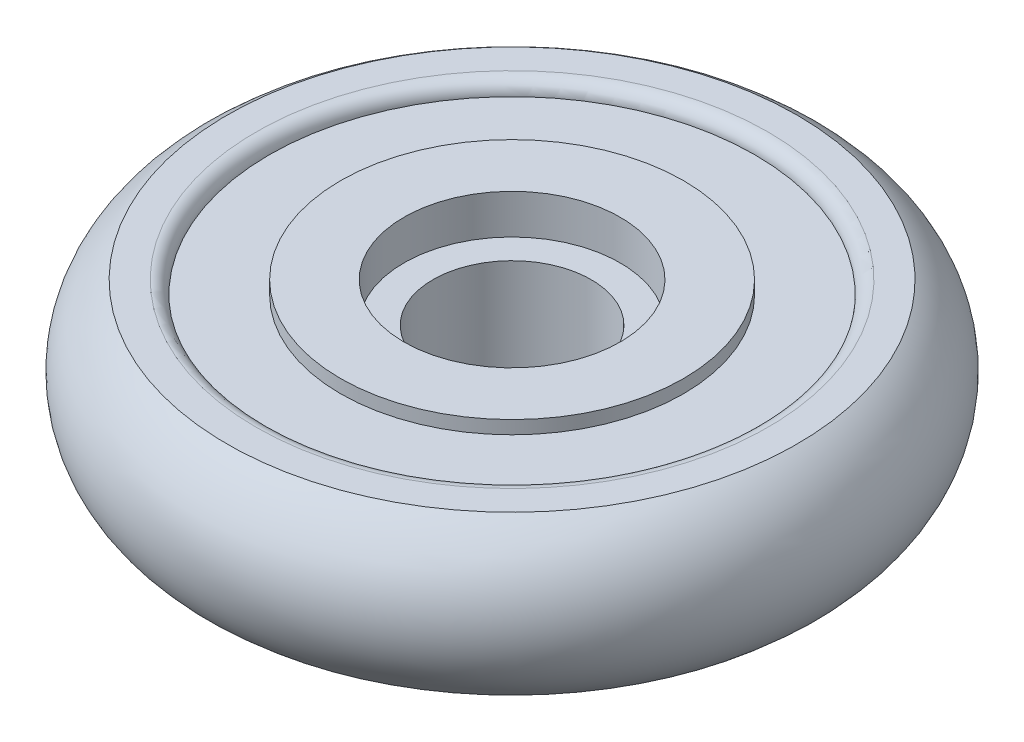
SolidWorks part; units mm, degrees
ref_plane "Front" through (0, 0, 0) normal (0, 0, 1) x (1, 0, 0)
ref_plane "Top" through (0, 0, 0) normal (0, 1, 0) x (1, 0, 0)
ref_plane "Right" through (0, 0, 0) normal (1, 0, 0) x (0, 0, -1)
sketch "Sketch1" plane through (0, 0, 0) normal (0, 0, 1) x (1, 0, 0)
  line L0 (0, 0) -> (0, 48.1545) construction
  line L1 (0, 0) -> (10.8028, 0)
  line L2 (10.8028, -6) -> (5.5, -6)
  line L3 (5.5, -6) -> (5.5, -9)
  line L4 (5.5, -9) -> (0, -9)
  line L7 (0, 0) -> (0, -9)
  arc A0 (10.8028, 0) -> (10.8028, -6) centre (9, -3) cw
  dimension "D1" = 3.5
  dimension "D4" = 25
  dimension "D3" = 11
  dimension "D6" = 6
  dimension "D7" = 9
revolve "Revolve1" add sketch "Sketch1" angle 360 about L0
sketch "Sketch2" plane through (0, 0, 0) normal (0, 1, 0) x (1, 0, 0)
  circle A0 centre (0, 0) radius 3
  dimension "D1" = 6
extrude "Extrude1" cut sketch "Sketch2" against normal through all
sketch "Sketch3" plane through (0, -6, 0) normal (0, -1, 0) x (1, 0, 0)
  circle A0 centre (0, 0) radius 5.5 construction
  circle A1 centre (0, 0) radius 5.5
  circle A2 centre (0, 0) radius 8.2
  dimension "D1" = 2.7
extrude "Extrude2" cut sketch "Sketch3" against normal blind 0.5
sketch "Sketch4" plane through (0, 0, 0) normal (0, 1, 0) x (1, 0, 0)
  circle A2 centre (0, 0) radius 9.2
  circle A4 centre (0, 0) radius 6.5
extrude "Extrude3" cut sketch "Sketch4" against normal blind 0.5
fillet "Fillet3" radius 0.5 2 edges at (0, 0, 9.2) (0, -6, -8.2)
sketch "Sketch5" plane through (0, 0, 0) normal (0, 1, 0) x (1, 0, 0)
  circle A0 centre (0, 0) radius 3 construction
  circle A1 centre (0, 0) radius 3
  circle A2 centre (0, 0) radius 4.1
  dimension "D1" = 1.1
extrude "Extrude4" cut sketch "Sketch5" against normal blind 1.5
sketch "Sketch6" plane through (0, -9, 0) normal (0, -1, 0) x (1, 0, 0)
  circle A0 centre (0, 0) radius 5.5 construction
  circle A1 centre (0, 0) radius 5.5
chamfer "Chamfer2" distance 0.2 angle 45 1 edges at (0, -9, -5.5)
